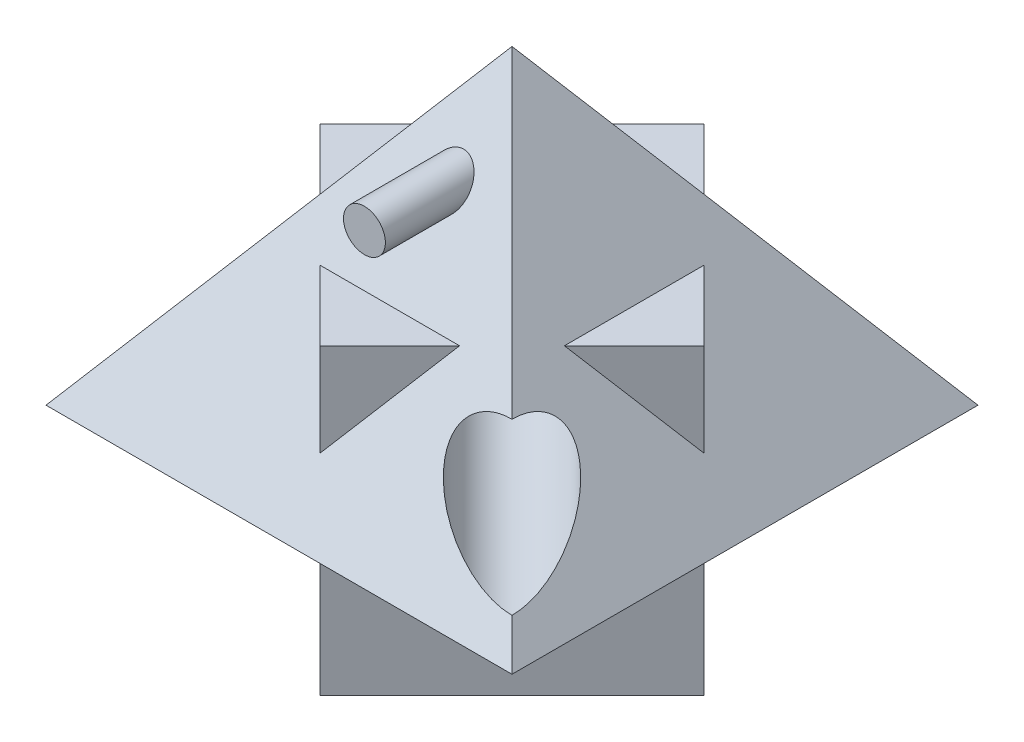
SolidWorks part; units mm, degrees
ref_plane "Front Plane" through (0, 0, 0) normal (0, 0, 1) x (1, 0, 0)
ref_plane "Top Plane" through (0, 0, 0) normal (0, 1, 0) x (1, 0, 0)
ref_plane "Right Plane" through (0, 0, 0) normal (1, 0, 0) x (0, 0, -1)
sketch "Sketch1" plane through (0, 0, 0) normal (0, 1, 0) x (1, 0, 0)
  line L1 (-76.2, -76.2) -> (76.2, -76.2)
  line L2 (-76.2, -76.2) -> (-76.2, 76.2)
  line L3 (-76.2, 76.2) -> (76.2, 76.2)
  line L4 (76.2, -76.2) -> (76.2, 76.2)
  line L5 (-76.2, -76.2) -> (76.2, 76.2) construction
  line L6 (-76.2, 76.2) -> (76.2, -76.2) construction
  point P0 (0, 0)
  dimension "D1" = 152.4
ref_plane "Plane1" through (0, 101.6, 0) normal (0, 1, 0) x (1, 0, 0)
sketch "Sketch2" plane through (0, 101.6, 0) normal (0, 1, 0) x (1, 0, 0)
  point P0 (0, 0)
loft "Loft1" add profiles "Sketch1", "Sketch2"
ref_plane "Plane2" through (0, -50.8, 0) normal (0, 1, 0) x (1, 0, 0)
sketch "Sketch3" plane through (0, -50.8, 0) normal (0, -1, 0) x (1, 0, 0)
  line L0 (0, -62.8618) -> (62.8618, 0)
  line L1 (0, -62.8618) -> (-62.8618, 0)
  line L2 (62.8618, 0) -> (0, 62.8618)
  line L3 (-62.8618, 0) -> (0, 62.8618)
  line L4 (0, -62.8618) -> (0, 62.8618) construction
  line L5 (62.8618, 0) -> (-62.8618, 0) construction
  point P1 (0, 0)
  dimension "D1" = 88.9
extrude "Boss-Extrude1" add sketch "Sketch3" against normal blind 99.06
sketch "Sketch4" plane through (31.4309, 0, 31.4309) normal (0.7071, 0, 0.7071) x (0.7071, 0, -0.7071)
  line L0 (0, 0) -> (0, 101.6) construction
  line L1 (0, 25.4) -> (0, 0) construction
  circle A0 centre (0, 25.4) radius 15.875
  dimension "D1" = 31.75
  dimension "D2" = 25.4
extrude "Cut-Extrude1" cut sketch "Sketch4" against normal through all and the other way through all
sketch "Sketch5" plane through (0, 0, 0) normal (0, 0, 1) x (1, 0, 0)
  circle A0 centre (0, 73.6174) radius 6.8527
extrude "Boss-Extrude2" add sketch "Sketch5" along normal blind 48.26
